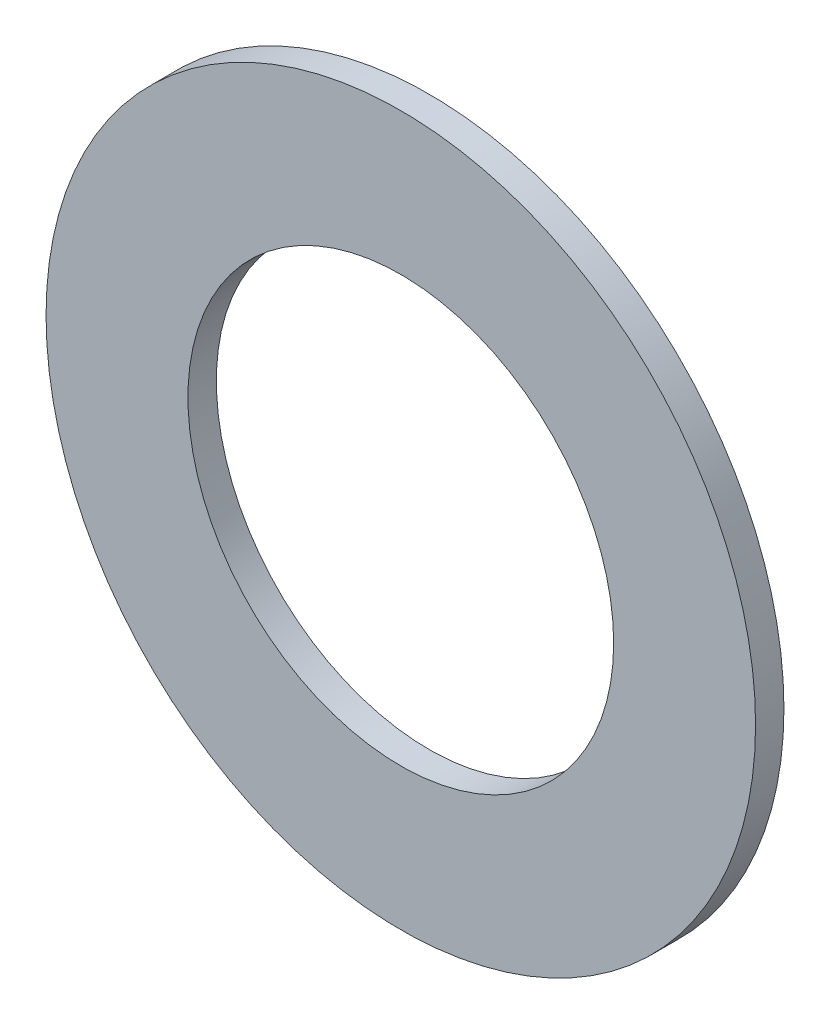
SolidWorks part; units mm, degrees
ref_plane "Piano frontale" through (0, 0, 0) normal (0, 0, 1) x (1, 0, 0)
ref_plane "Piano superiore" through (0, 0, 0) normal (0, 1, 0) x (1, 0, 0)
ref_plane "Piano destro" through (0, 0, 0) normal (1, 0, 0) x (0, 0, -1)
sketch "Schizzo1" plane through (0, 0, 0) normal (0, 0, 1) x (1, 0, 0)
  circle A0 centre (0, 0) radius 15
  circle A1 centre (0, 0) radius 25
  dimension "D1" = 30
  dimension "D2" = 50
extrude "Estrusione1" add sketch "Schizzo1" along normal blind 2
